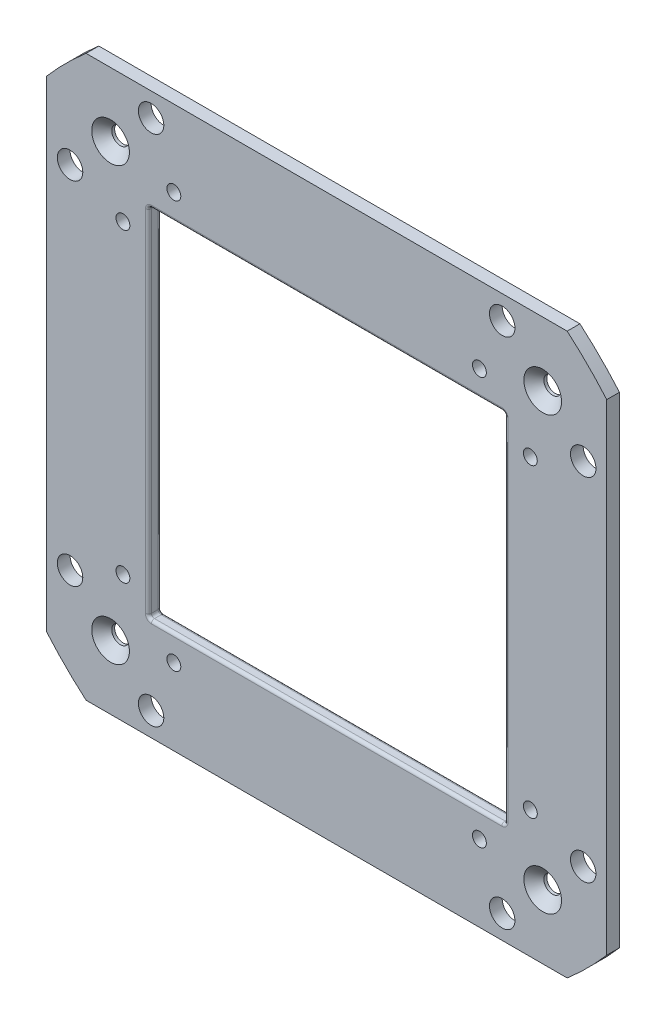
SolidWorks part; units mm, degrees
ref_plane "Front" through (0, 0, 0) normal (0, 0, 1) x (1, 0, 0)
ref_plane "Top" through (0, 0, 0) normal (0, 1, 0) x (1, 0, 0)
ref_plane "Right" through (0, 0, 0) normal (1, 0, 0) x (0, 0, -1)
sketch "Sketch1" plane through (0, 0, 0) normal (0, 0, 1) x (1, 0, 0)
  line L0 (0, 66.3152) -> (0, -36.6987) construction
  line L1 (0, 0) -> (90.0299, 75.3289) construction
  line L2 (0, 0) -> (98.6144, -85.8449) construction
  line L3 (0, 0) -> (-107.4135, 83.055) construction
  line L4 (0, 0) -> (-108.9158, -63.5252) construction
  circle A0 centre (0, 0) radius 92.075
  dimension "D1" = 184.15
extrude "Base-Extrude" add sketch "Sketch1" against normal blind 3.175
sketch "Sketch2" plane through (0, 0, 0) normal (0, 0, 1) x (1, 0, 0)
  line L0 (0, 0) -> (0, 57.9664) construction
  line L1 (0, 0) -> (75.1252, 75.1252) construction
  line L2 (0, 0) -> (98.0208, -98.0208) construction
  line L3 (0, 0) -> (-75.1084, -75.1084) construction
  line L4 (0, 0) -> (-85.0573, 85.0573) construction
  circle A0 centre (0, 0) radius 76.2 construction
  circle A1 centre (-53.8815, 53.8815) radius 2.159
  circle A2 centre (53.8815, 53.8815) radius 2.159
  circle A3 centre (53.8815, -53.8815) radius 2.159
  circle A4 centre (-53.8815, -53.8815) radius 2.159
  dimension "D1" = 152.4
  dimension "D2" = 45
  dimension "D6" = 4.318
  dimension "D7" = 4.318
  dimension "D8" = 4.318
  dimension "D9" = 4.318
  dimension "D3" = 45
  dimension "D4" = 90
  dimension "D5" = 90
extrude "mounting holes" cut sketch "Sketch2" against normal blind 3.175
sketch "Sketch3" plane through (0, 0, -3.175) normal (0, 0, -1) x (-1, 0, 0)
  line L1 (-118.1255, 106.8982) -> (137.2587, 106.8982)
  line L2 (-118.1255, 106.8982) -> (-118.1255, -115.6843)
  line L3 (-118.1255, -115.6843) -> (137.2587, -115.6843)
  line L4 (137.2587, 106.8982) -> (137.2587, -115.6843)
  line L5 (-69.85, 69.85) -> (69.85, 69.85)
  line L6 (-69.85, 69.85) -> (-69.85, -69.85)
  line L7 (-69.85, -69.85) -> (69.85, -69.85)
  line L8 (69.85, 69.85) -> (69.85, -69.85)
  dimension "D1" = 139.7
  dimension "D2" = 69.85
  dimension "D3" = 69.85
  dimension "D4" = 139.7
extrude "trim flats" cut sketch "Sketch3" against normal blind 3.175
sketch "Sketch4" plane through (0, 0, -3.175) normal (0, 0, -1) x (-1, 0, 0)
  line L4 (-44.45, 44.45) -> (44.45, 44.45)
  line L5 (-44.45, 44.45) -> (-44.45, -44.45)
  line L6 (-44.45, -44.45) -> (44.45, -44.45)
  line L7 (44.45, 44.45) -> (44.45, -44.45)
  dimension "D1" = 88.9
  dimension "D2" = 88.9
  dimension "D3" = 44.45
  dimension "D4" = 44.45
extrude "center hole" cut sketch "Sketch4" against normal blind 3.175
sketch "Sketch6" plane through (0, 0, -3.175) normal (0, 0, -1) x (-1, 0, 0)
  line L0 (-38.1, 68.1782) -> (-38.1, -74.6853) construction
  line L1 (38.1, 68.1782) -> (38.1, -77.8287) construction
  line L2 (-94.3779, 38.1) -> (92.6491, 38.1) construction
  line L3 (-94.3779, -38.1) -> (89.3486, -38.1) construction
  line L4 (-50.6859, 50.8) -> (61.216, 50.8) construction
  line L5 (-54.1435, -50.8) -> (55.8724, -50.8) construction
  line L6 (50.8, 58.5911) -> (50.8, -68.5559) construction
  line L7 (-50.8, 58.5911) -> (-50.8, -76.7285) construction
  circle A0 centre (-38.1, 50.8) radius 1.7272
  circle A1 centre (-50.8, 38.1) radius 1.7272
  circle A2 centre (-50.8, -38.1) radius 1.7272
  circle A3 centre (-38.1, -50.8) radius 1.7272
  circle A4 centre (38.1, -50.8) radius 1.7272
  circle A5 centre (50.8, -38.1) radius 1.7272
  circle A6 centre (38.1, 50.8) radius 1.7272
  circle A7 centre (50.8, 38.1) radius 1.7272
  dimension "D9" = 3.4544
  dimension "D10" = 3.4544
  dimension "D11" = 3.4544
  dimension "D12" = 3.4544
  dimension "D13" = 3.4544
  dimension "D14" = 3.4544
  dimension "D15" = 3.4544
  dimension "D16" = 3.4544
  dimension "D1" = 38.1
  dimension "D2" = 76.2
  dimension "D3" = 38.1
  dimension "D4" = 76.2
  dimension "D5" = 101.6
  dimension "D6" = 50.8
  dimension "D7" = 101.6
  dimension "D8" = 50.8
extrude "spacer mount holes" cut sketch "Sketch6" against normal through all
fillet "Fillet1" radius 0.762
chamfer "Chamfer1" distance 2.54 angle 44
sketch "Sketch7" plane through (0, 0, 0) normal (0, 0, 1) x (1, 0, 0)
  circle A0 centre (-43.7787, 63.9843) radius 3.175
  circle A1 centre (43.7787, 63.9843) radius 3.175
  circle A2 centre (-63.9843, 43.7787) radius 3.175
  circle A3 centre (-43.7787, -63.9843) radius 3.175
  circle A4 centre (63.9843, -43.7787) radius 3.175
  circle A5 centre (-63.9843, -43.7787) radius 3.175
  circle A6 centre (43.7787, -63.9843) radius 3.175
  circle A7 centre (63.9843, 43.7787) radius 3.175
  dimension "D1" = 6.35
  dimension "D2" = 6.35
  dimension "D3" = 6.35
  dimension "D4" = 6.35
  dimension "D5" = 6.35
  dimension "D6" = 6.35
  dimension "D7" = 6.35
  dimension "D8" = 6.35
extrude "Cut-Extrude1" cut sketch "Sketch7" against normal through all
